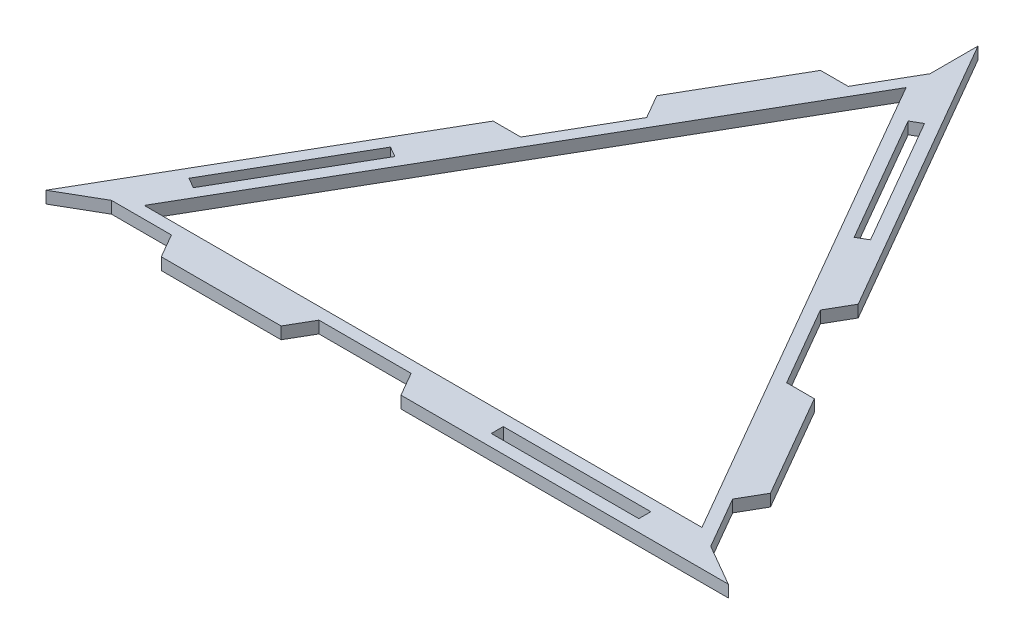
SolidWorks part; units mm, degrees
ref_plane "Alzado" through (0, 0, 0) normal (0, 0, 1) x (1, 0, 0)
ref_plane "Planta" through (0, 0, 0) normal (0, 1, 0) x (1, 0, 0)
ref_plane "Vista lateral" through (0, 0, 0) normal (1, 0, 0) x (0, 0, -1)
sketch "Croquis1" plane through (0, 0, 0) normal (0, 1, 0) x (1, 0, 0)
  line L0 (0, 328.6751) -> (136.547, 92.1688)
  line L1 (0, 288.6751) -> (-250, -144.3376) construction
  line L2 (-250, -144.3376) -> (250, -144.3376) construction
  line L3 (250, -144.3376) -> (0, 288.6751) construction
  line L4 (284.641, -164.3376) -> (11.547, -164.3376)
  line L5 (136.547, 92.1688) -> (125, 72.1688)
  line L6 (0, 328.6751) -> (0, 288.6751)
  line L7 (0, 288.6751) -> (-25, 245.3739)
  line L8 (-25, 245.3739) -> (-48.094, 245.3739)
  line L9 (-48.094, 245.3739) -> (-98.094, 158.7713)
  line L10 (-98.094, 158.7713) -> (-86.547, 138.7713)
  line L11 (-86.547, 138.7713) -> (-125, 72.1688)
  line L12 (-125, 72.1688) -> (-148.094, 72.1688)
  line L13 (-148.094, 72.1688) -> (-284.641, -164.3376)
  line L14 (125, 72.1688) -> (163.453, 5.5662)
  line L15 (11.547, -164.3376) -> (0, -144.3376)
  line L16 (-76.906, -144.3376) -> (0, -144.3376)
  line L17 (163.453, 5.5662) -> (186.547, 5.5662)
  line L18 (186.547, 5.5662) -> (236.547, -81.0363)
  line L19 (236.547, -81.0363) -> (225, -101.0363)
  line L20 (225, -101.0363) -> (250, -144.3376)
  line L21 (250, -144.3376) -> (284.641, -164.3376)
  line L22 (25, 245.3739) -> (86.547, 138.7713)
  line L23 (-76.906, -144.3376) -> (-88.453, -164.3376)
  line L24 (-88.453, -164.3376) -> (-188.453, -164.3376)
  line L25 (-188.453, -164.3376) -> (-200, -144.3376)
  line L26 (-200, -144.3376) -> (-250, -144.3376)
  line L27 (-250, -144.3376) -> (-284.641, -164.3376)
  line L28 (86.547, 138.7713) -> (95.2073, 143.7713)
  line L29 (95.2073, 143.7713) -> (33.6603, 250.3739)
  line L30 (33.6603, 250.3739) -> (25, 245.3739)
  line L31 (200, -144.3376) -> (76.906, -144.3376)
  line L32 (76.906, -144.3376) -> (76.906, -154.3376)
  line L33 (76.906, -154.3376) -> (200, -154.3376)
  line L34 (200, -154.3376) -> (200, -144.3376)
  line L35 (-225, -101.0363) -> (-163.453, 5.5662)
  line L36 (-163.453, 5.5662) -> (-172.1132, 10.5662)
  line L37 (-172.1132, 10.5662) -> (-233.6603, -96.0363)
  line L38 (-233.6603, -96.0363) -> (-225, -101.0363)
  line L39 (-163.453, 5.5662) -> (-76.906, -144.3376) construction
  line L40 (-225, -101.0363) -> (-200, -144.3376) construction
  line L41 (76.906, -144.3376) -> (163.453, 5.5662) construction
  line L42 (200, -144.3376) -> (225, -101.0363) construction
  line L43 (0, 268.6751) -> (-232.6795, -134.3376)
  line L44 (232.6795, -134.3376) -> (0, 268.6751)
  line L45 (-232.6795, -134.3376) -> (232.6795, -134.3376)
  line L46 (8.6603, 283.6751) -> (-241.3397, -149.3376) construction
  line L47 (-250, -134.3376) -> (250, -134.3376) construction
  line L48 (241.3397, -149.3376) -> (-8.6603, 283.6751) construction
  circle A0 centre (0, 0) radius 144.3376 construction
  point P41 (0, 0)
  dimension "D1" = 500
  dimension "100" = 100
  dimension "D3" = 100
  dimension "D4" = 100
  dimension "D5" = 50
  dimension "D6" = 20
  dimension "D7" = 10
  dimension "D9" = 10
  dimension "D8" = 3
extrude "Saliente-Extruir1" add sketch "Croquis1" along normal blind 10
equation "\"a\"=500"
equation "\"D1@Croquis1\"=\"a\""
equation "\"pestaña\" = 100"
equation "\"100@Croquis1\"=\"pestaña\""
equation "\"D3@Croquis1\"=\"pestaña\""
equation "\"D4@Croquis1\"=\"pestaña\""
equation "\"separacion\"= 50"
equation "\"D5@Croquis1\"=\"separacion\""
